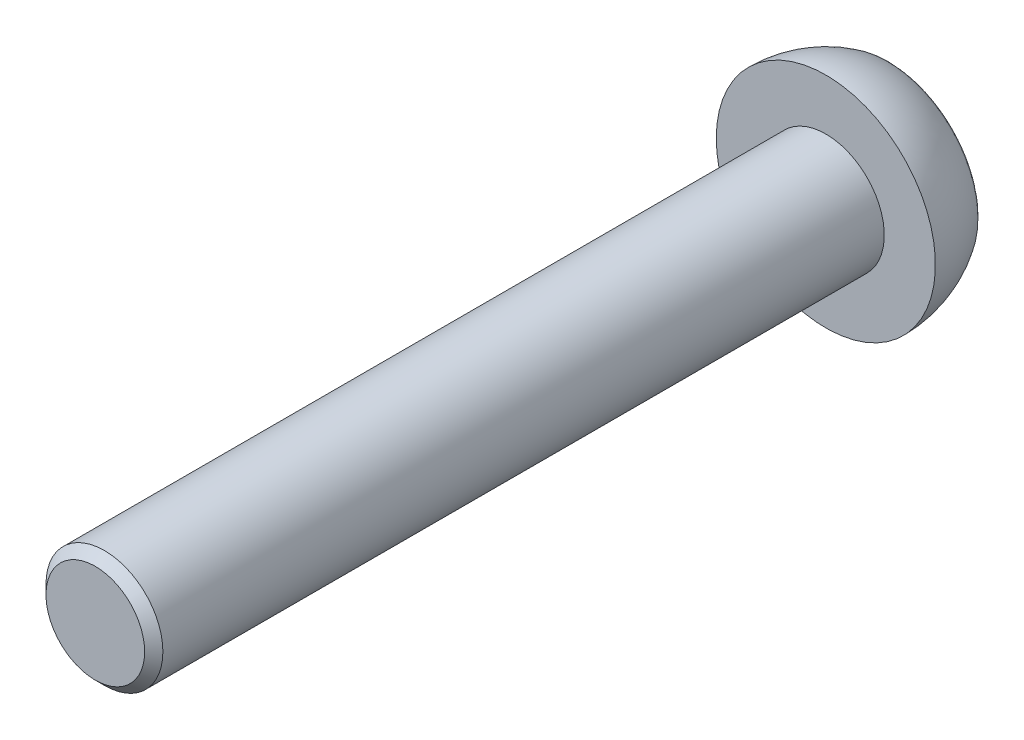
SolidWorks part; units mm, degrees
ref_plane "Face" through (0, 0, 0) normal (0, 0, 1) x (1, 0, 0)
ref_plane "Dessus" through (0, 0, 0) normal (0, 1, 0) x (1, 0, 0)
ref_plane "Droite" through (0, 0, 0) normal (1, 0, 0) x (0, 0, -1)
imported_body "Importée1"
sketch "Esquisse1" plane through (0, 0, -35) normal (0, 0, 1) x (1, 0, 0)
  circle A0 centre (60.6999, 219.3355) radius 4 construction
  circle A1 centre (60.6999, 219.3355) radius 4
extrude "Extrusion1" add sketch "Esquisse1" along normal blind 50
chamfer "Chanfrein1" distance 0.625 angle 45
